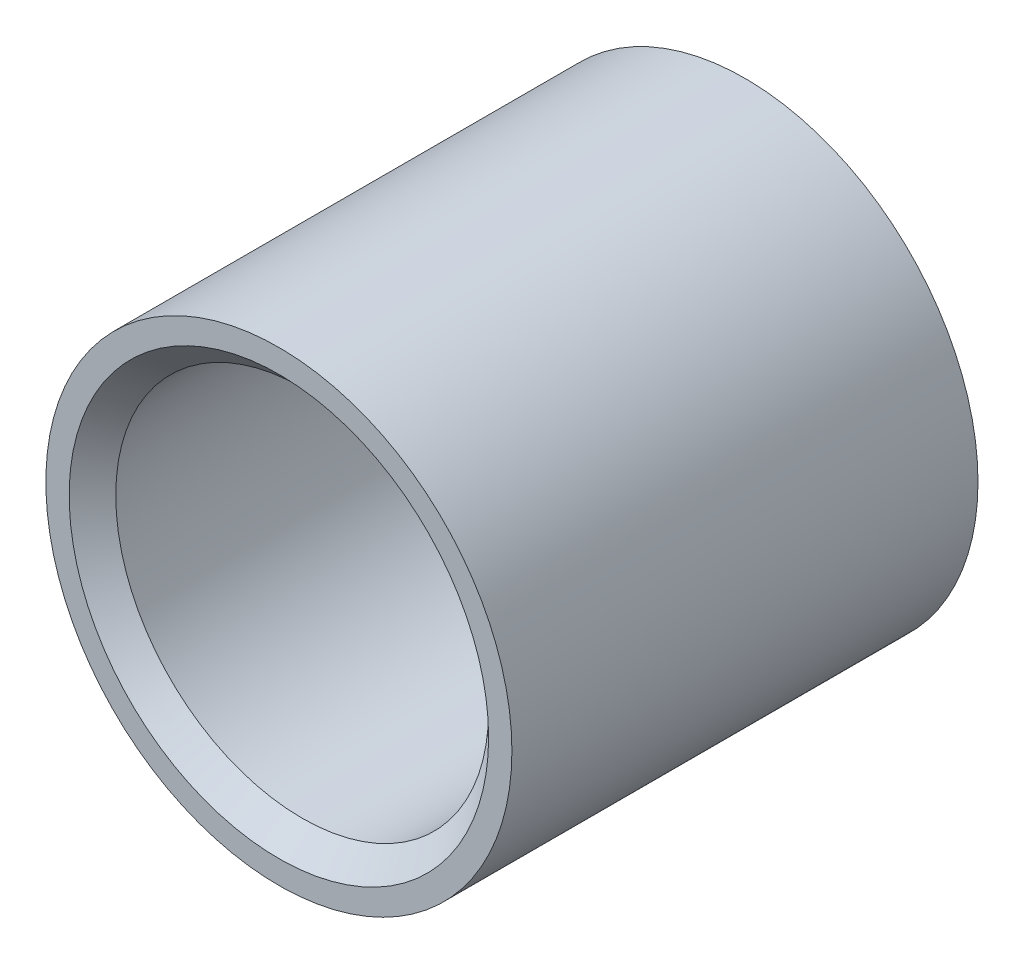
SolidWorks part; units mm, degrees
ref_plane "Plan de face" through (0, 0, 0) normal (0, 0, 1) x (1, 0, 0)
ref_plane "Plan de dessus" through (0, 0, 0) normal (0, 1, 0) x (1, 0, 0)
ref_plane "Plan de droite" through (0, 0, 0) normal (1, 0, 0) x (0, 0, -1)
sketch "Esquisse1" plane through (0, 0, 0) normal (0, 0, 1) x (1, 0, 0)
  circle A0 centre (0, 0) radius 2
  circle A1 centre (0, 0) radius 2.5
extrude "Boss.-Extru.1" add sketch "Esquisse1" along normal blind 5
chamfer "Chanfrein1" distance 0.25 angle 45 2 edges at (2, 0, 0) (2, 0, 5)
